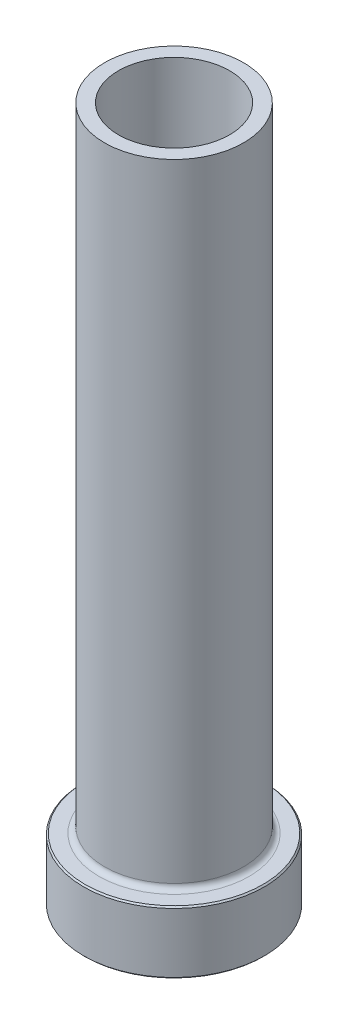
SolidWorks part; units mm, degrees
ref_plane "Front Plane" through (0, 0, 0) normal (0, 0, 1) x (1, 0, 0)
ref_plane "Top Plane" through (0, 0, 0) normal (0, 1, 0) x (1, 0, 0)
ref_plane "Right Plane" through (0, 0, 0) normal (1, 0, 0) x (0, 0, -1)
sketch "Sketch1" plane through (0, 0, 0) normal (0, 0, 1) x (1, 0, 0)
  line L0 (-8, 100) -> (-10, 100)
  line L1 (-10, 100) -> (-10, 9)
  line L2 (-10, 9) -> (-13, 9)
  line L3 (-13, 9) -> (-13, 0)
  line L4 (13.2, 0) -> (-13.2, 0) construction
  line L5 (-13, 0) -> (-8.25, 0)
  line L6 (-8, 45) -> (-8, 100)
  line L7 (0, 92.1877) -> (0, -15.5353) construction
  line L8 (0, -13.2) -> (0, 13.2) construction
  line L9 (-8, 45) -> (-8.25, 33)
  line L10 (-8.25, 33) -> (-8.25, 0)
  dimension "D1" = 0.25
  dimension "ID" = 16
  dimension "OD" = 20
  dimension "L" = 100
  dimension "H" = 26
  dimension "T" = 9
  dimension "N" = 55
  dimension "D2" = 12
revolve "Revolve1" add sketch "Sketch1" angle 360 about L7
fillet "Fillet1" radius 0.8 1 edges at (0, 9, 10)
chamfer "Chamfer1" distance 0.2 angle 45 2 edges at (0, 9, 13) (0, 0, 13)
chamfer "Chamfer3" distance 0.5 angle 45 1 edges at (0, 0, 8.25)
